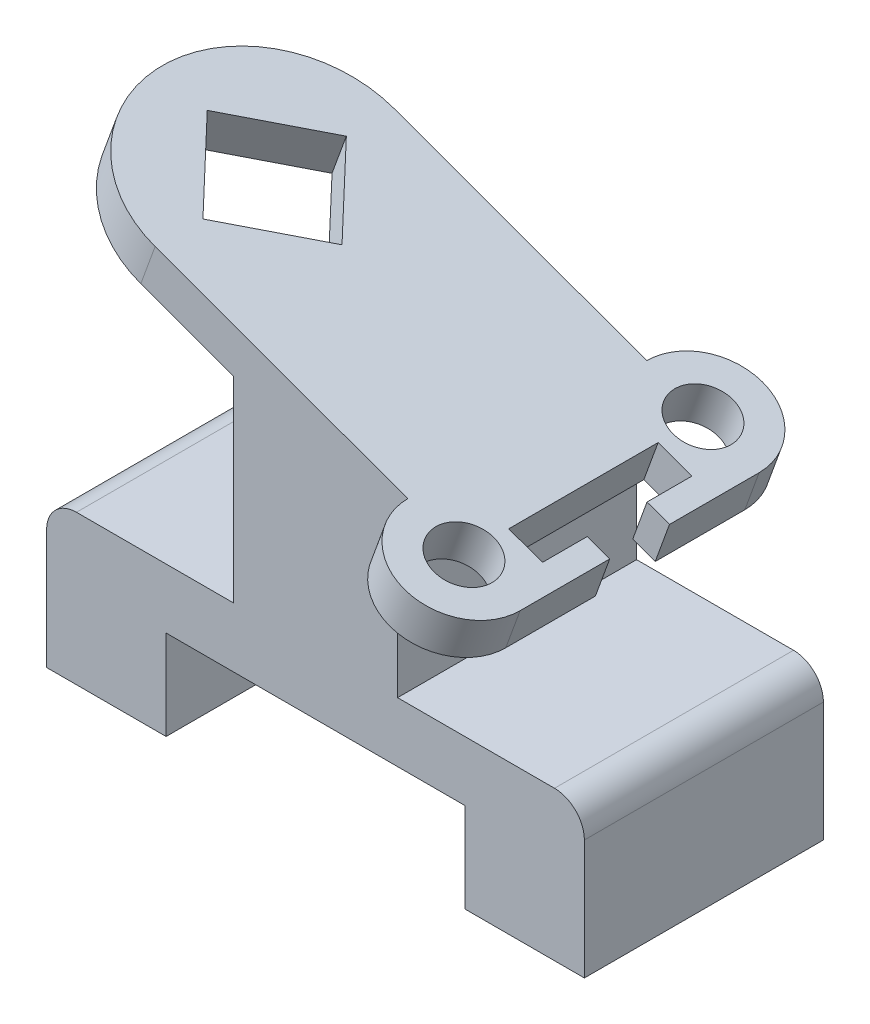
SolidWorks part; units mm, degrees
ref_plane "Front Plane" through (0, 0, 0) normal (0, 0, 1) x (1, 0, 0)
ref_plane "Top Plane" through (0, 0, 0) normal (0, 1, 0) x (1, 0, 0)
ref_plane "Right Plane" through (0, 0, 0) normal (1, 0, 0) x (0, 0, -1)
sketch "Sketch1" plane through (0, 0, 0) normal (0, 0, 1) x (1, 0, 0)
  line L0 (0, 0) -> (0, 56.7755) construction
  line L1 (25, 15) -> (-25, 15)
  line L2 (-25, 15) -> (-25, 0)
  line L3 (25, 15) -> (25, 0)
  line L4 (-25, 0) -> (-45, 0)
  line L5 (25, 0) -> (45, 0)
  line L6 (-45, 0) -> (-45, 20)
  line L7 (45, 0) -> (45, 20)
  line L8 (-40, 25) -> (-13.7374, 25)
  line L9 (40, 25) -> (13.7374, 25)
  line L10 (-13.7374, 25) -> (-13.7374, 60)
  line L11 (13.7374, 25) -> (13.7374, 50)
  line L12 (-13.7374, 60) -> (13.7374, 50)
  arc A0 (-45, 20) -> (-40, 25) centre (-40, 20) cw
  arc A1 (45, 20) -> (40, 25) centre (40, 20) ccw
  point P6 (0, 15)
  point P18 (-45, 25)
  point P21 (45, 25)
  dimension "D8" = 5
  dimension "D1" = 50
  dimension "D2" = 20
  dimension "D3" = 25
  dimension "D4" = 15
  dimension "D5" = 25
  dimension "D6" = 35
  dimension "D7" = 110
extrude "Extrude1" add sketch "Sketch1" along normal mid plane 40
sketch "Sketch2" plane through (17.6767, 48.5662, 0) normal (0.342, 0.9397, 0) x (-0.9397, 0.342, 0)
  line L0 (4.1921, 0) -> (62.6682, 0) construction
  line L1 (4.1921, 20) -> (4.1921, -20) construction
  line L2 (4.1921, 20) -> (33.4301, 20) construction
  line L3 (-15.8079, 5) -> (-11.8079, 5)
  line L4 (-11.8079, 5) -> (-11.8079, 12.5)
  line L5 (-11.8079, 12.5) -> (-5.8079, 12.5)
  line L6 (-15.8079, -5) -> (-15.8079, -20)
  line L7 (4.1921, -20) -> (49.1921, -20)
  line L8 (4.1921, 20) -> (49.1921, 20)
  line L9 (-15.8079, 5) -> (-15.8079, 20)
  line L10 (-5.8079, 12.5) -> (-5.8079, -12.5)
  line L11 (-11.8079, -12.5) -> (-5.8079, -12.5)
  line L12 (-11.8079, -5) -> (-11.8079, -12.5)
  line L13 (-15.8079, -5) -> (-11.8079, -5)
  line L14 (4.1921, -20) -> (33.4301, -20) construction
  arc A0 (-15.8079, -20) -> (4.1921, -20) centre (-5.8079, -20) ccw
  arc A1 (49.1921, -20) -> (49.1921, 20) centre (49.1921, 0) ccw
  arc A2 (-15.8079, 20) -> (4.1921, 20) centre (-5.8079, 20) cw
  point P25 (-5.8079, 0)
  dimension "D2" = 10
  dimension "D1" = 4
  dimension "D3" = 25
  dimension "D4" = 45
  dimension "D8" = 15
extrude "Extrude2" add sketch "Sketch2" along normal blind 5 and the other way blind 2
hole_wizard "Ø10.0 (10) Diameter Hole1" positions "Sketch4" profile "Sketch3" hole size "Ø10.0" standard "Ansi Metric"
sketch "Sketch4" plane through (19.3868, 53.2647, 0) normal (0.342, 0.9397, 0) x (-0.9397, 0.342, 0)
  point P1 (-5.8079, -20)
  point P4 (-5.8079, 20)
sketch "Sketch3" plane through (24.8444, 51.2783, -20) normal (0, 0, 1) x (-0.9397, 0.342, 0)
  line L0 (0, 0) -> (0, 7)
  line L1 (0, 7) -> (5, 7)
  line L2 (5, 7) -> (5, 0)
  line L5 (5, 0) -> (0, 0)
  line L11 (0, -6.35) -> (0, 107.95) construction
  dimension "Thru Hole Dia." = 10
  dimension "Thru Hole Depth" = 7
sketch "Sketch7" plane through (19.3868, 53.2647, 0) normal (0.342, 0.9397, 0) x (-0.9397, 0.342, 0)
  line L1 (61.1921, 0) -> (49.1921, 12)
  line L2 (49.1921, 12) -> (37.1921, 0)
  line L3 (37.1921, 0) -> (49.1921, -12)
  line L4 (49.1921, -12) -> (61.1921, 0)
  circle A0 centre (49.1921, 0) radius 8.4853 construction
  dimension "D1" = 12
extrude "Cut-Extrude1" cut sketch "Sketch7" against normal up to next
